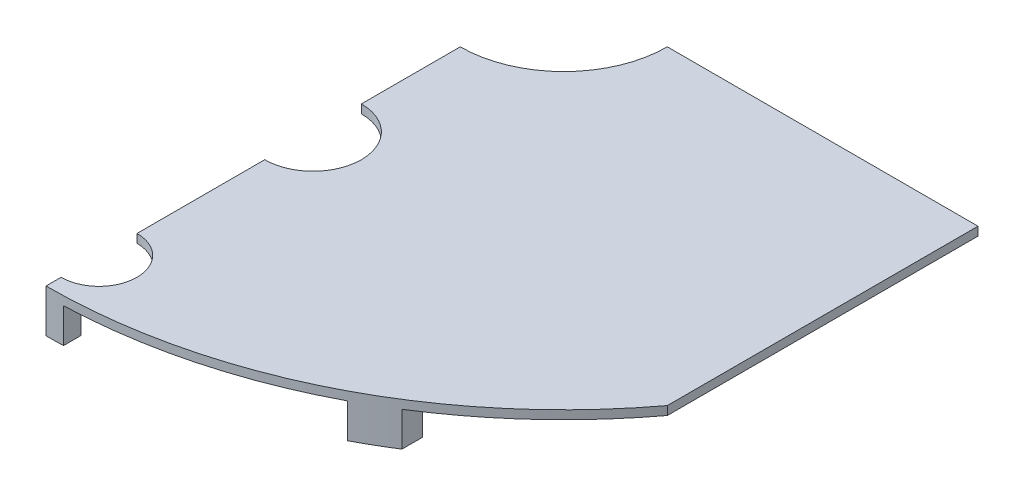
SolidWorks part; units mm, degrees
ref_plane "Front Plane" through (0, 0, 0) normal (0, 0, 1) x (1, 0, 0)
ref_plane "Top Plane" through (0, 0, 0) normal (0, 1, 0) x (1, 0, 0)
ref_plane "Right Plane" through (0, 0, 0) normal (1, 0, 0) x (0, 0, -1)
sketch "Sketch1" plane through (0, 0, 0) normal (0, 1, 0) x (1, 0, 0)
  line L0 (0, 0) -> (150, 0)
  line L1 (150, 0) -> (-150, 0)
  circle A0 centre (0, 0) radius 150
  circle A1 centre (0, 0) radius 145
  circle A2 centre (0, 0) radius 30
  dimension "D1" = 300
  dimension "D2" = 290
  dimension "D3" = 60
extrude "Boss-Extrude1" add sketch "Sketch1" along normal blind 2.5 contours A2 L1 A1 | A1 L1 A0
sketch "Sketch3" plane through (0, 2.5, 0) normal (0, 1, 0) x (1, 0, 0)
  line L0 (0, 0) -> (0, -150)
  arc A0 (-150, 0) -> (150, 0) centre (0, 0) ccw construction
  circle A1 centre (0, -134.6406) radius 11
  dimension "D1" = 22
extrude "Cut-Extrude2" cut sketch "Sketch3" against normal blind 10 contours L0 A1 | L0 A1
sketch "Sketch4" plane through (0, 0, 0) normal (0, -1, 0) x (1, 0, 0)
  line L0 (0, 0) -> (70, 0)
  line L1 (30, 0) -> (150, 0) construction
  line L2 (70, 0) -> (70, 132.665)
  line L3 (70, 0) -> (80, 0)
  line L4 (80, 0) -> (80, 126.8858)
  line L5 (0, 0) -> (-70, 0)
  line L6 (-30, 0) -> (-150, 0) construction
  line L7 (-70, 0) -> (-70, 132.665)
  line L8 (-70, 0) -> (-80, 0)
  line L9 (-80, 0) -> (-80, 126.8858)
  line L10 (0, 0) -> (5, 0)
  line L11 (0, 0) -> (-5, 0)
  line L12 (5, 0) -> (5, 149.9166)
  line L13 (-5, 0) -> (-5, 149.9166)
  circle A0 centre (0, 0) radius 150
  circle A1 centre (0, 0) radius 145
  dimension "D1" = 290
  dimension "D2" = 70
  dimension "D3" = 10
  dimension "D4" = 70
  dimension "D5" = 10
  dimension "D6" = 5
  dimension "D7" = 5
extrude "Boss-Extrude2" add sketch "Sketch4" along normal blind 10 contours A1 L7 L9 M9 | A1 L12 L13 M9 M6 | A1 L4 L2 M9
sketch "Sketch5" plane through (0, 2.5, 0) normal (0, 1, 0) x (1, 0, 0)
  line L0 (0, 0) -> (0, -150)
  line L1 (0, -123.6406) -> (0, -86.6406)
  arc A1 (-150, 0) -> (150, 0) centre (0, 0) ccw construction
  circle A2 centre (0, -72.6406) radius 14
  circle A3 centre (0, -134.6406) radius 11
  dimension "D1" = 28
  dimension "D2" = 37
extrude "Cut-Extrude3" cut sketch "Sketch5" against normal blind 10 contours L0 A2 | L0 A2
sketch "Sketch6" plane through (0, 2.5, 0) normal (0, 1, 0) x (1, 0, 0)
  line L0 (0, 0) -> (0, -190.9183)
  line L1 (0, -190.9183) -> (-184.6106, -190.9183)
  line L2 (-184.6106, -190.9183) -> (-184.6106, 0)
  line L3 (-184.6106, 0) -> (0, 0)
extrude "Cut-Extrude4" cut sketch "Sketch6" against normal blind 159
sketch "Sketch7" plane through (0, 2.5, 0) normal (0, 1, 0) x (1, 0, 0)
  line L0 (0, 0) -> (120, 0)
  line L1 (30, 0) -> (150, 0) construction
  line L2 (120, 0) -> (120, -134.1927)
  line L3 (120, -134.1927) -> (177.4832, -134.1927)
  line L4 (177.4832, -134.1927) -> (177.4832, 0)
  line L5 (177.4832, 0) -> (120, 0)
  dimension "D1" = 120
extrude "Cut-Extrude5" cut sketch "Sketch7" against normal blind 159 contours L2 M4 M3
